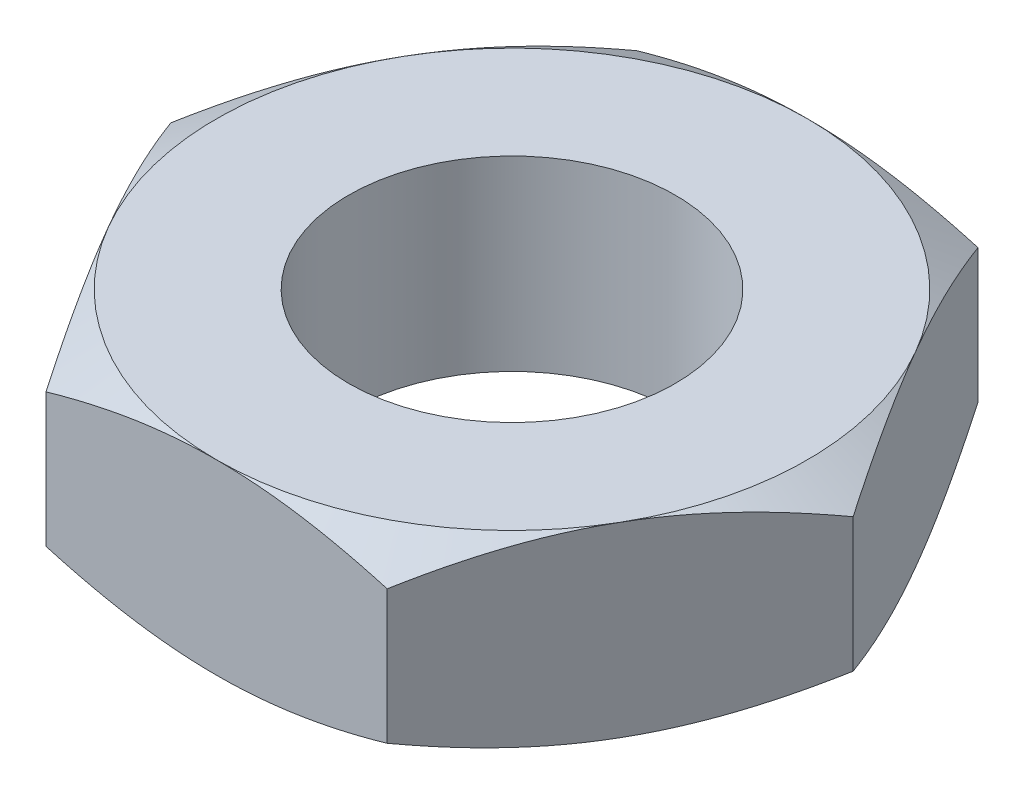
SolidWorks part; units mm, degrees
ref_plane "Front Plane" through (0, 0, 0) normal (0, 0, 1) x (1, 0, 0)
ref_plane "Top Plane" through (0, 0, 0) normal (0, 1, 0) x (1, 0, 0)
ref_plane "Right Plane" through (0, 0, 0) normal (1, 0, 0) x (0, 0, -1)
sketch "Sketch1" plane through (0, 0, 0) normal (0, 1, 0) x (1, 0, 0)
  line L1 (5.4848, -9.5) -> (10.9697, 0)
  line L2 (10.9697, 0) -> (5.4848, 9.5)
  line L3 (5.4848, 9.5) -> (-5.4848, 9.5)
  line L4 (-5.4848, 9.5) -> (-10.9697, 0)
  line L5 (-10.9697, 0) -> (-5.4848, -9.5)
  line L6 (-5.4848, -9.5) -> (5.4848, -9.5)
  circle A0 centre (0, 0) radius 9.5 construction
  dimension "D1" = 19
extrude "Extrude1" add sketch "Sketch1" along normal blind 6
sketch "Sketch2" plane through (0, 0, 0) normal (1, 0, 0) x (0, 0, -1)
  line L0 (9.5, 6) -> (12.9641, 6)
  line L1 (12.9641, 6) -> (12.9641, 4)
  line L2 (9.5, 6) -> (9.5, 0) construction
  line L3 (12.9641, 4) -> (9.5, 6)
  line L4 (9.5, 3) -> (19.7285, 3) construction
  line L5 (12.9641, 0) -> (12.9641, 2)
  line L6 (9.5, 0) -> (12.9641, 0)
  line L7 (12.9641, 2) -> (9.5, 0)
  line L8 (0, 0) -> (0, 9.8652) construction
  dimension "D1" = 30
  dimension "D2" = 2
revolve "Cut-Revolve1" cut sketch "Sketch2" angle 360 about L8
hole_wizard "M14x1.5 Tapped Hole1" positions "Sketch5" profile "Sketch6" tap size "M12x1.5" standard "Ansi Metric"
sketch "Sketch5" plane through (0, 6, 0) normal (0, 1, 0) x (-1, 0, 0)
  point P1 (0, 0)
sketch "Sketch6" plane through (0, 6, 0) normal (1, 0, 0) x (0, 0, 1)
  line L0 (0, 0) -> (0, 6)
  line L1 (0, 6) -> (5.25, 6)
  line L2 (5.25, 6) -> (5.25, 0)
  line L5 (5.25, 0) -> (0, 0)
  line L11 (0, -6.35) -> (0, 107.95) construction
  dimension "Thru Tap Drill Dia." = 10.5
  dimension "Thru Tap Drill Depth" = 6
